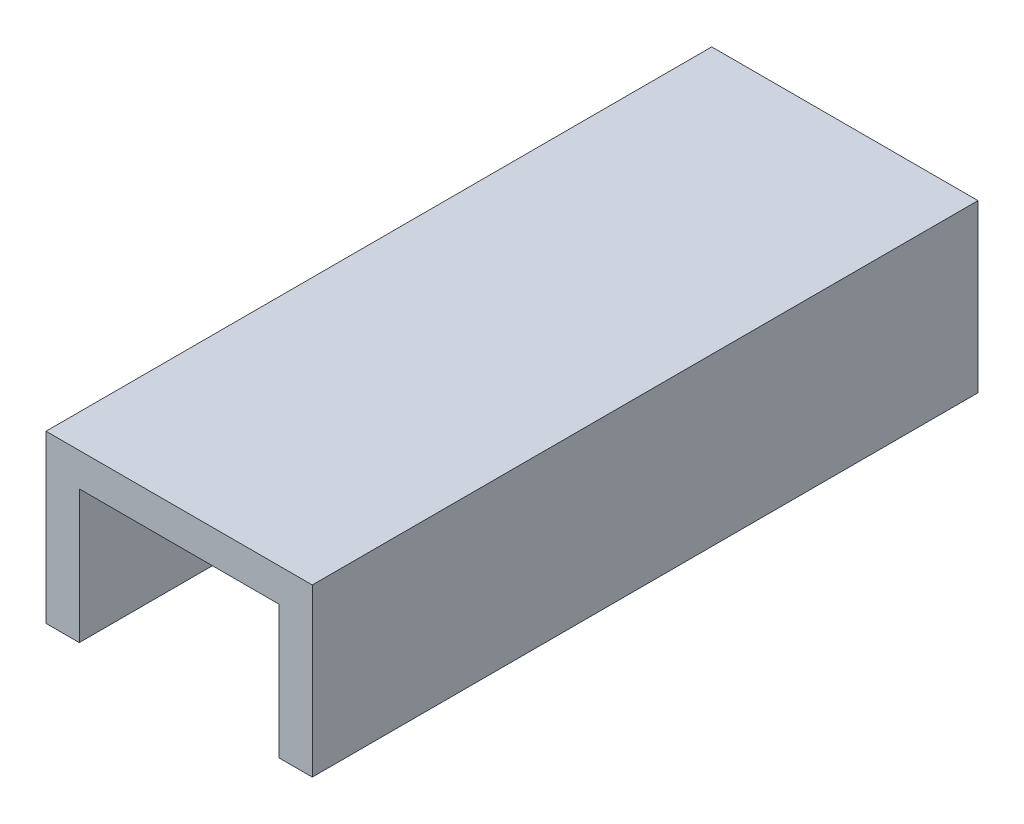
SolidWorks part; units mm, degrees
ref_plane "Vorne" through (0, 0, 0) normal (0, 0, 1) x (1, 0, 0)
ref_plane "Oben" through (0, 0, 0) normal (0, 1, 0) x (1, 0, 0)
ref_plane "Rechts" through (0, 0, 0) normal (1, 0, 0) x (0, 0, -1)
sketch "Skizze1" plane through (0, 0, 0) normal (0, 0, 1) x (1, 0, 0)
  line L0 (-40, 10) -> (40, 10)
  line L1 (40, 10) -> (40, -40)
  line L2 (40, -40) -> (30, -40)
  line L3 (30, -40) -> (30, 0)
  line L4 (30, 0) -> (-30, 0)
  line L5 (-30, 0) -> (-30, -40)
  line L6 (-30, -40) -> (-40, -40)
  line L7 (-40, -40) -> (-40, 10)
  line L8 (0, 38.896) -> (0, -46.2658) construction
  line L9 (0, -55) -> (0, 55) construction
  dimension "D1" = 80
  dimension "D2" = 50
  dimension "D3" = 60
  dimension "D4" = 10
extrude "Linear austragen1" add sketch "Skizze1" along normal blind 200
sketch "Mittellinie" plane through (0, 10, 0) normal (0, 1, 0) x (-1, 0, 0)
  line L0 (0, 200) -> (0, 0) construction
  line L1 (-40, 200) -> (40, 200) construction
  line L2 (-40, 0) -> (40, 0) construction
